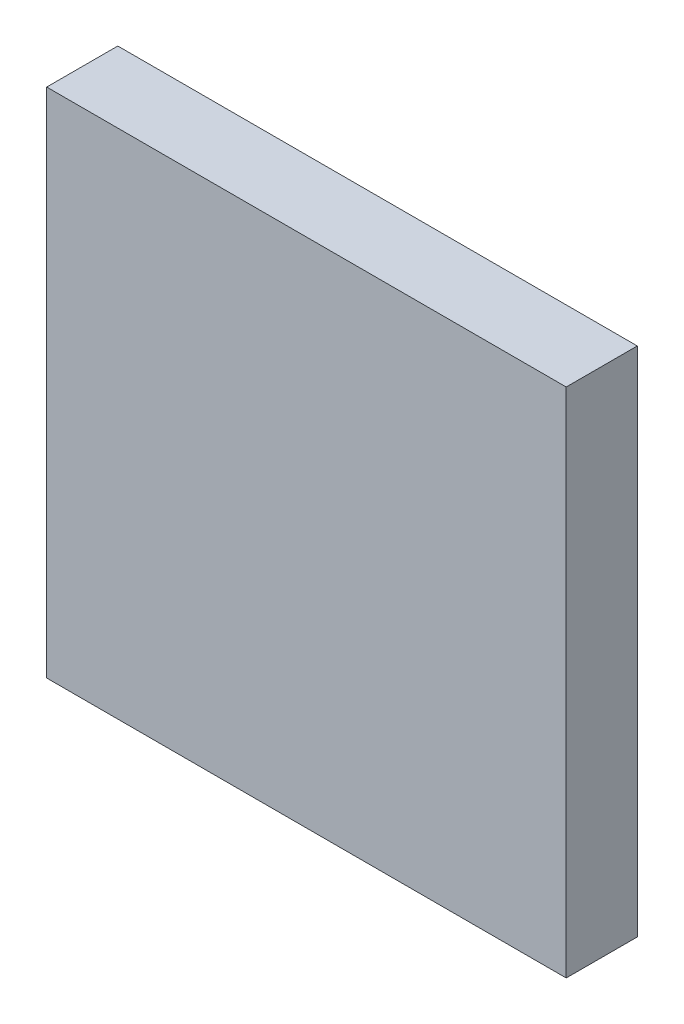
SolidWorks part; units mm, degrees
ref_plane "Front Plane" through (0, 0, 0) normal (0, 0, 1) x (1, 0, 0)
ref_plane "Top Plane" through (0, 0, 0) normal (0, 1, 0) x (1, 0, 0)
ref_plane "Right Plane" through (0, 0, 0) normal (1, 0, 0) x (0, 0, -1)
sketch "Sketch1" plane through (0, 0, 0) normal (0, 0, 1) x (1, 0, 0)
  line L1 (-26.8203, 17.3272) -> (9.7197, 17.3272)
  line L2 (-26.8203, 17.3272) -> (-26.8203, -18.6728)
  line L3 (-26.8203, -18.6728) -> (9.7197, -18.6728)
  line L4 (9.7197, 17.3272) -> (9.7197, -18.6728)
extrude "Boss-Extrude1" add sketch "Sketch1" along normal blind 5
